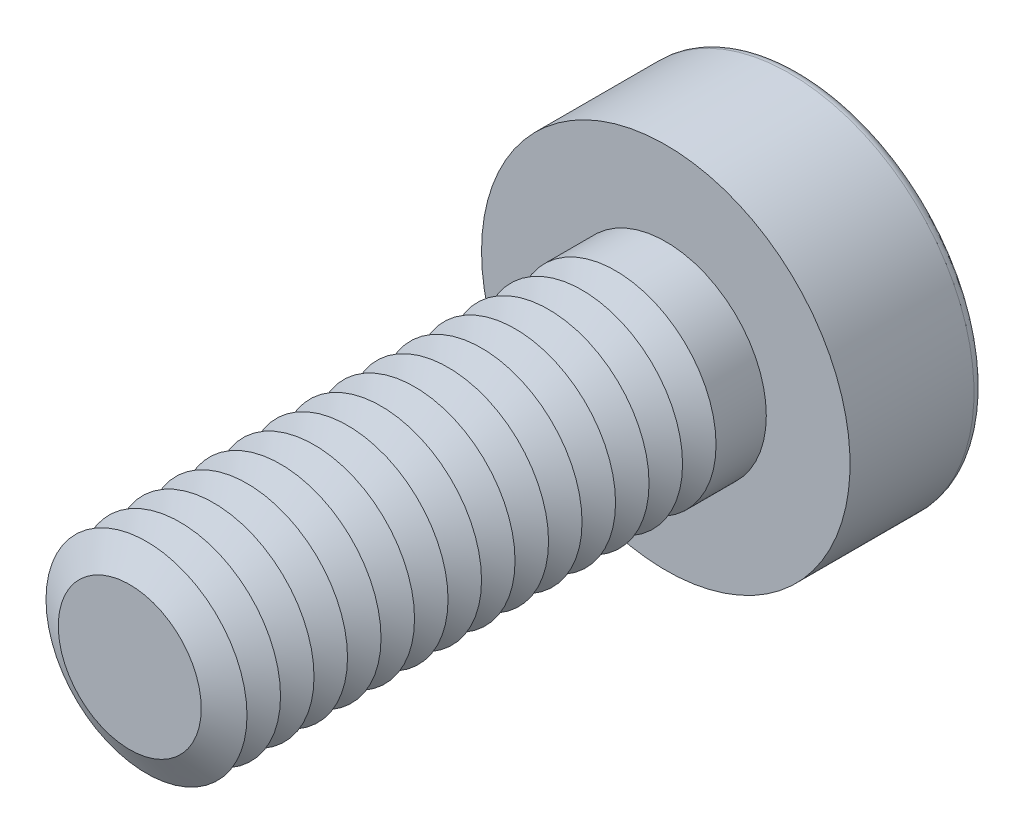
SolidWorks part; units mm, degrees
ref_plane "Front Plane" through (0, 0, 0) normal (0, 0, 1) x (1, 0, 0)
ref_plane "Top Plane" through (0, 0, 0) normal (0, 1, 0) x (1, 0, 0)
ref_plane "Right Plane" through (0, 0, 0) normal (1, 0, 0) x (0, 0, -1)
sketch "Sketch1" plane through (0, 0, 0) normal (0, 0, 1) x (1, 0, 0)
  circle A0 centre (0, 0) radius 1.5
  dimension "D1" = 3
extrude "Boss-Extrude1" add sketch "Sketch1" along normal blind 8
sketch "Sketch2" plane through (0, 0, 0) normal (0, 0, -1) x (-1, 0, 0)
  circle A0 centre (0, 0) radius 2.75
  dimension "D1" = 5.5
extrude "Boss-Extrude2" add sketch "Sketch2" along normal blind 2
sketch "Sketch3" plane through (0, 0, -2) normal (0, 0, -1) x (-1, 0, 0)
  line L1 (-0.5774, 1) -> (-1.1547, 0)
  line L2 (-1.1547, 0) -> (-0.5774, -1)
  line L3 (-0.5774, -1) -> (0.5774, -1)
  line L4 (0.5774, -1) -> (1.1547, 0)
  line L5 (1.1547, 0) -> (0.5774, 1)
  line L6 (0.5774, 1) -> (-0.5774, 1)
  circle A0 centre (0, 0) radius 1 construction
  dimension "D1" = 2
extrude "Cut-Extrude1" cut sketch "Sketch3" against normal blind 1.5
fillet "Fillet1" radius 0.15 1 edges at (-2.75, 0, -2)
sketch "Sketch4" plane through (0, 0, -0.5) normal (0, 0, -1) x (-1, 0, 0)
  line L0 (0.5774, -1) -> (1.1547, 0) construction
  circle A0 centre (0, 0) radius 1
extrude "Cut-Extrude2" cut sketch "Sketch4" against normal through all draft 60
sketch "Sketch5" plane through (0, 0, -2) normal (0, 0, -1) x (-1, 0, 0)
  circle A0 centre (0, 0) radius 1.1547
extrude "Cut-Extrude3" cut sketch "Sketch5" against normal through all draft 75
sketch "Sketch7" plane through (0, 0, 0) normal (1, 0, 0) x (0, 0, -1)
  line L25 (-8, 1.067) -> (-7.75, 1.5)
  line L26 (-8, 1.5) -> (-8, -1.5) construction
  line L27 (-7.75, 1.5) -> (-8.25, 1.5)
  line L28 (-8.25, 1.5) -> (-8, 1.067)
  line L29 (0, 1.5) -> (-8, 1.5) construction
  dimension "D1" = 0.5
revolve "Cut-Revolve1" cut sketch "Sketch7" angle 360 about axis through (0, 0, 8) along (0, 0, -1)
pattern_linear "LPattern1" count 15 spacing 0.5 along (0, 0, -1) of "Cut-Revolve1"
